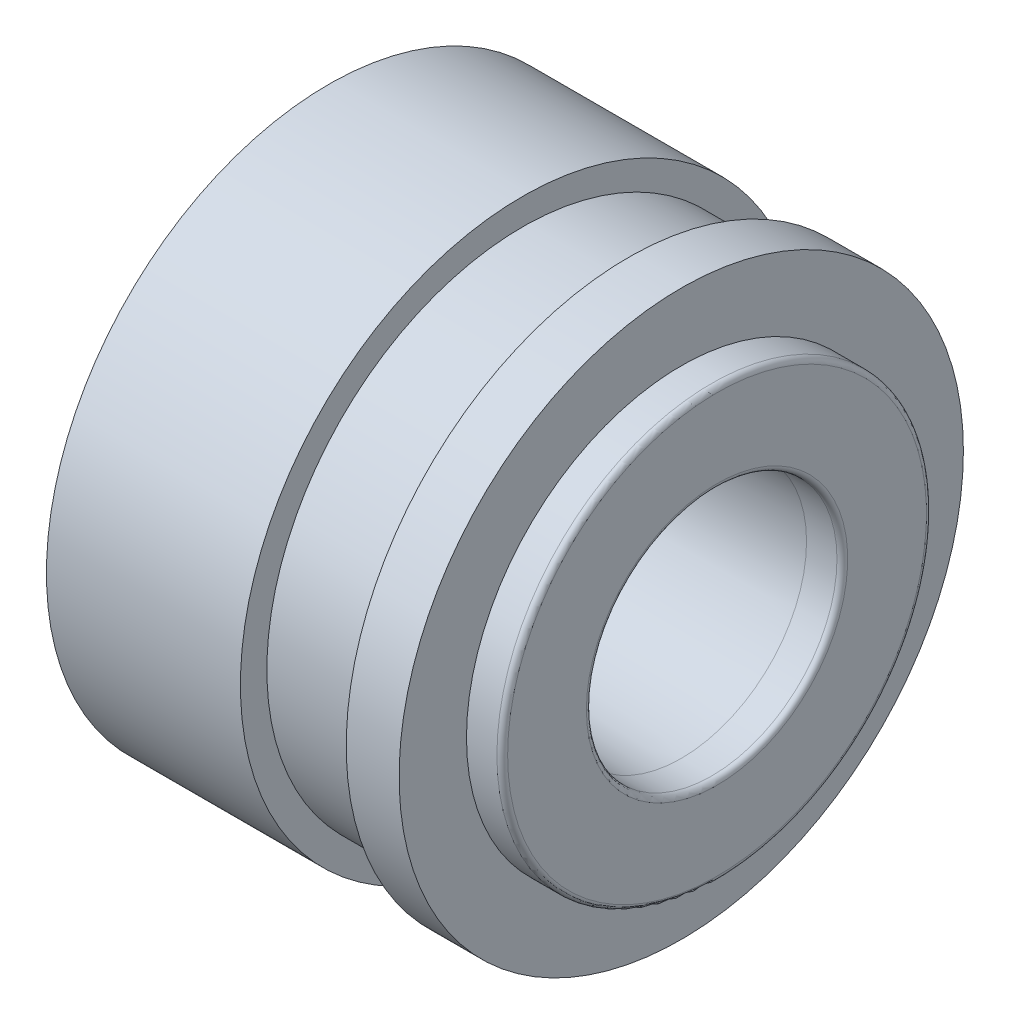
SolidWorks part; units mm, degrees
ref_plane "Face" through (0, 0, 0) normal (0, 0, 1) x (1, 0, 0)
ref_plane "Dessus" through (0, 0, 0) normal (0, 1, 0) x (1, 0, 0)
ref_plane "Droite" through (0, 0, 0) normal (1, 0, 0) x (0, 0, -1)
sketch "Esquisse1" plane through (0, 0, 0) normal (0, 0, 1) x (1, 0, 0)
  line L0 (35.4426, 0) -> (-38.695, 0) construction
  line L1 (0, 0) -> (0, 12.5)
  line L2 (-5, 16) -> (-8, 16)
  line L3 (-8, 16) -> (-8, 14.5)
  line L4 (-8, 14.5) -> (-14, 14.5)
  line L5 (-14, 14.5) -> (-14, 16)
  line L6 (-14, 16) -> (-25, 16)
  line L7 (-25, 16) -> (-25, 0)
  line L8 (0, 0) -> (-25, 0)
  line L9 (-5, 16) -> (-5, 12.5)
  line L10 (-5, 12.5) -> (0, 12.5)
  dimension "D1" = 32
  dimension "D2" = 3
  dimension "D3" = 11
  dimension "D4" = 25
  dimension "D5" = 6
  dimension "D6" = 1.5
  dimension "D7" = 0
  dimension "D8" = 25
revolve "Base-Révolution" add sketch "Esquisse1" angle 360 about L0
sketch "Esquisse2" plane through (0, 0, 0) normal (1, 0, 0) x (0, 0, -1)
  circle A0 centre (0, 0) radius 6
  dimension "D1" = 12
extrude "Enlèv. mat.-Extru.1" cut sketch "Esquisse2" against normal through all
chamfer "Chanfrein1" distance 2 angle 45 1 edges at (0, 0, -12.5)
other "Empreinte1"
other "Embout_guidon_R1-5<1>@creation empreintes1"
chamfer "Chanfrein2" distance 1 angle 45 1 edges at (-25, 0, -6)
